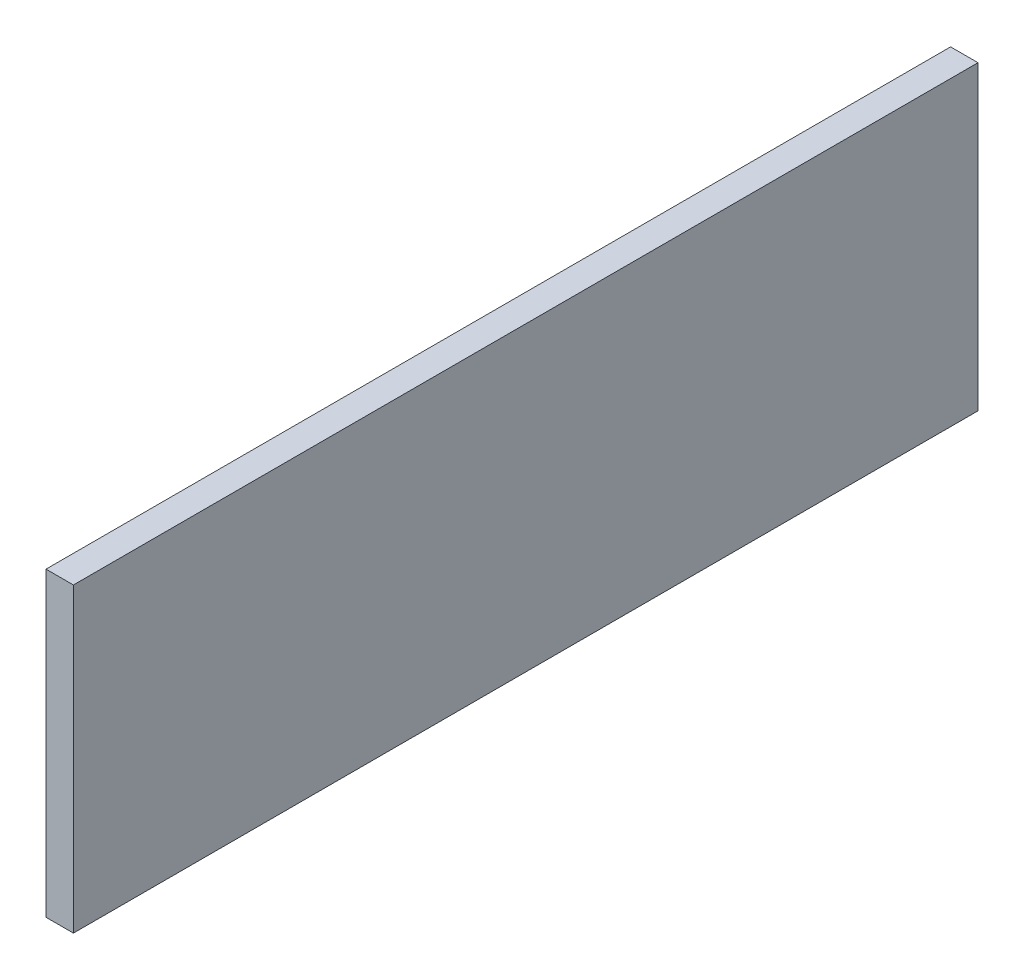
SolidWorks part; units mm, degrees
ref_plane "Front" through (0, 0, 0) normal (0, 0, 1) x (1, 0, 0)
ref_plane "Top" through (0, 0, 0) normal (0, 1, 0) x (1, 0, 0)
ref_plane "Right" through (0, 0, 0) normal (1, 0, 0) x (0, 0, -1)
sketch "Sketch1" plane through (0, 0, 0) normal (1, 0, 0) x (0, 0, -1)
  line L0 (-209.55, 69.85) -> (209.55, -69.85) construction
  line L1 (-209.55, 69.85) -> (209.55, 69.85)
  line L2 (-209.55, 69.85) -> (-209.55, -69.85)
  line L3 (-209.55, -69.85) -> (209.55, -69.85)
  line L4 (209.55, 69.85) -> (209.55, -69.85)
  point P4 (0, 0)
  dimension "D1" = 419.1
  dimension "D3" = 139.7
extrude "Extrude1" add sketch "Sketch1" along normal blind 12.7
